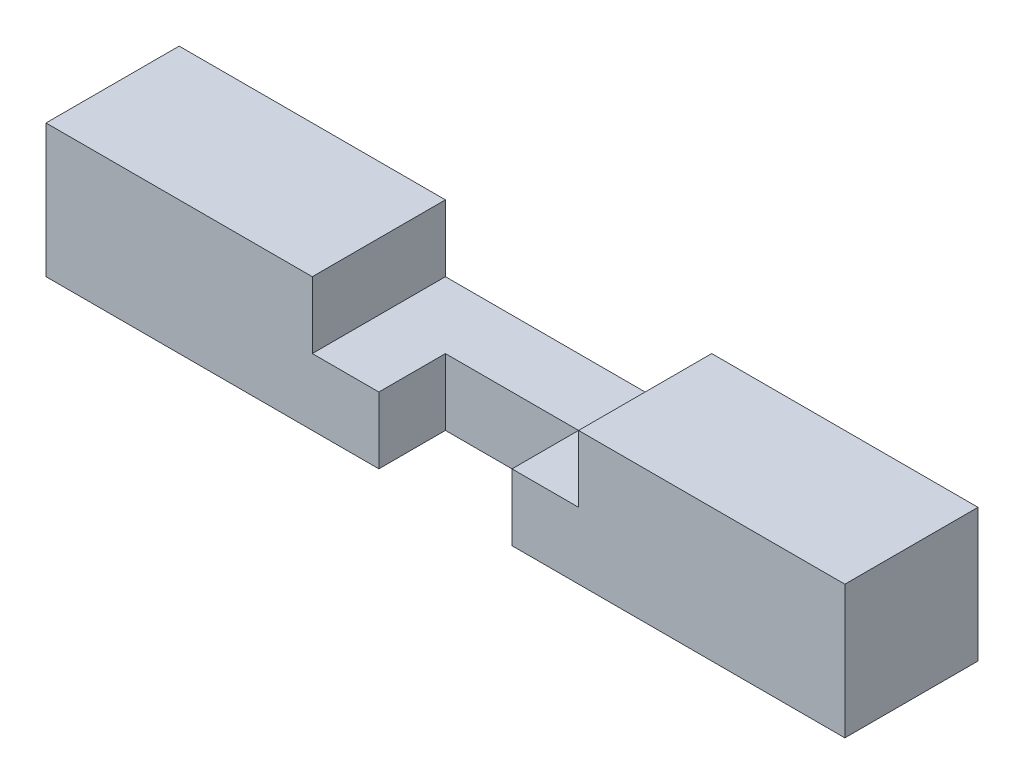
SolidWorks part; units mm, degrees
ref_plane "Front Plane" through (0, 0, 0) normal (0, 0, 1) x (1, 0, 0)
ref_plane "Top Plane" through (0, 0, 0) normal (0, 1, 0) x (1, 0, 0)
ref_plane "Right Plane" through (0, 0, 0) normal (1, 0, 0) x (0, 0, -1)
sketch "Sketch1" plane through (0, 0, 0) normal (0, 1, 0) x (1, 0, 0)
  line L1 (0, 0) -> (120, 0)
  line L2 (0, 0) -> (0, 20)
  line L3 (0, 20) -> (120, 20)
  line L4 (120, 0) -> (120, 20)
  dimension "D1" = 120
  dimension "D2" = 20
extrude "Extrude1" add sketch "Sketch1" along normal blind 20
sketch "Sketch2" plane through (0, 0, 0) normal (0, 0, 1) x (1, 0, 0)
  line L0 (0, 20) -> (120, 20) construction
  line L1 (40, 20) -> (80, 20)
  line L2 (40, 20) -> (40, 10)
  line L3 (40, 10) -> (80, 10)
  line L4 (80, 20) -> (80, 10)
  line L5 (0, 20) -> (0, 0) construction
  dimension "D1" = 10
  dimension "D2" = 40
  dimension "D3" = 40
extrude "Extrude2" cut sketch "Sketch2" against normal through all
sketch "Sketch3" plane through (0, 10, 0) normal (0, 1, 0) x (1, 0, 0)
  line L0 (40, 0) -> (80, 0) construction
  line L1 (50, 0) -> (70, 0)
  line L2 (50, 0) -> (50, 10)
  line L3 (50, 10) -> (70, 10)
  line L4 (70, 0) -> (70, 10)
  line L5 (0, 20) -> (0, 0) construction
  dimension "D1" = 10
  dimension "D2" = 50
  dimension "D3" = 20
extrude "Extrude3" cut sketch "Sketch3" against normal through all
